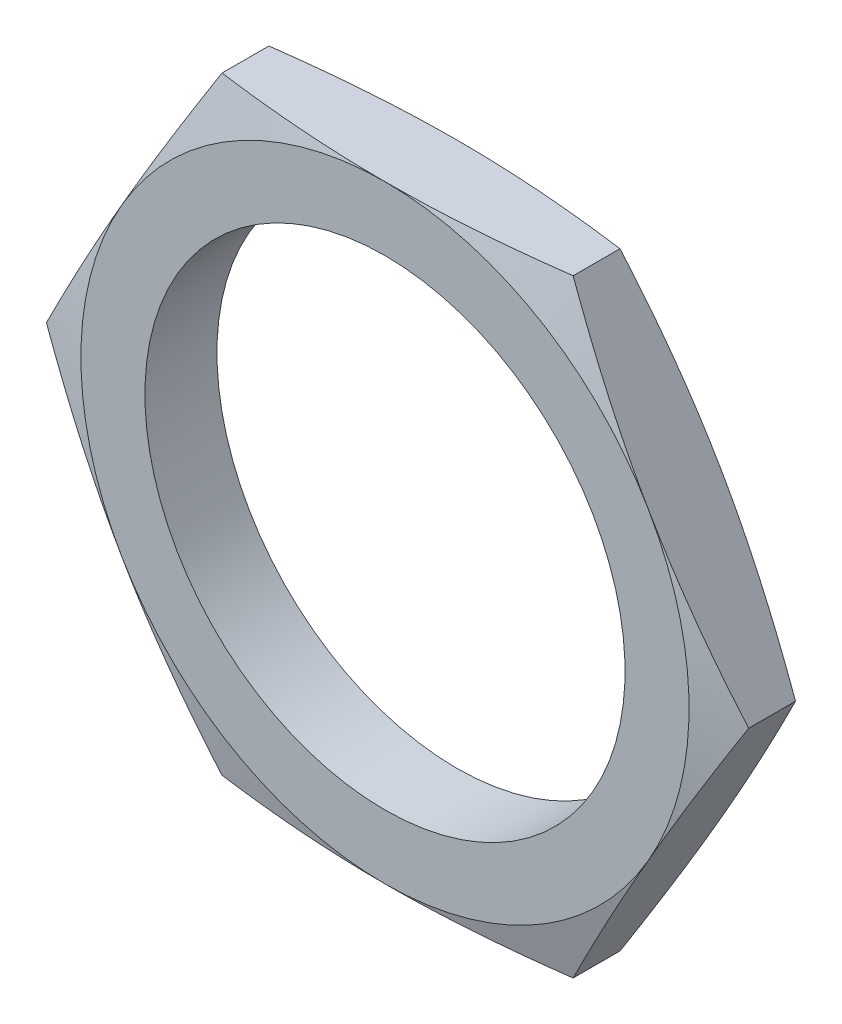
SolidWorks part; units mm, degrees
ref_plane "Front Plane" through (0, 0, 0) normal (0, 0, 1) x (1, 0, 0)
ref_plane "Top Plane" through (0, 0, 0) normal (0, 1, 0) x (1, 0, 0)
ref_plane "Right Plane" through (0, 0, 0) normal (1, 0, 0) x (0, 0, -1)
imported_body "Imported3"
hole_wizard "Hole1" positions "Sketch2" profile "Sketch1" legacy
sketch "Sketch2" plane through (0, 0, 11.2) normal (0, 0, -1) x (-1, 0, 0)
  point P0 (-60, 295)
sketch "Sketch1" plane through (60, 295, 11.2) normal (1, 0, 0) x (0, 1, 0)
  line L0 (0, 0) -> (0, 1.8)
  line L1 (0, 1.8) -> (6, 1.8)
  line L2 (6, 1.8) -> (6, 0)
  line L3 (6, 0) -> (0, 0)
  line L4 (0, 110) -> (0, -10) construction
  dimension "Diameter" = 12
  dimension "Depth" = 1.8
